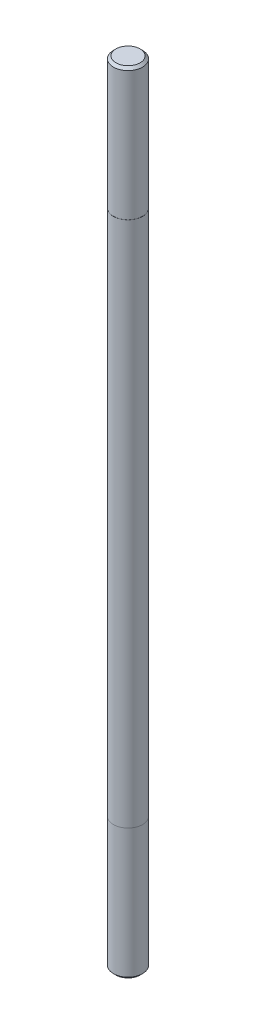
SolidWorks part; units mm, degrees
ref_plane "Front" through (0, 0, 0) normal (0, 0, 1) x (1, 0, 0)
ref_plane "Top" through (0, 0, 0) normal (0, 1, 0) x (1, 0, 0)
ref_plane "Right" through (0, 0, 0) normal (1, 0, 0) x (0, 0, -1)
sketch "Sketch1" plane through (0, 0, 0) normal (0, 1, 0) x (1, 0, 0)
  circle A0 centre (0, 0) radius 2
extrude "Extrude1" add sketch "Sketch1" along normal blind 108
chamfer "Chamfer2" distance 0.35 angle 45 2 edges at (0, 0, 2) (0, 108, 2)
sketch "Sketch2" plane through (0, 108, 0) normal (0, 1, 0) x (-1, 0, 0)
  circle A0 centre (0, 0) radius 7.1781
  circle A1 centre (0, 0) radius 1.99
extrude "Cut-Extrude1" cut sketch "Sketch2" against normal blind 18
sketch "Sketch3" plane through (0, 0, 0) normal (0, -1, 0) x (1, 0, 0)
  circle A0 centre (0, 0) radius 6.8037
  circle A1 centre (0, 0) radius 1.99
extrude "Cut-Extrude2" cut sketch "Sketch3" against normal blind 18
